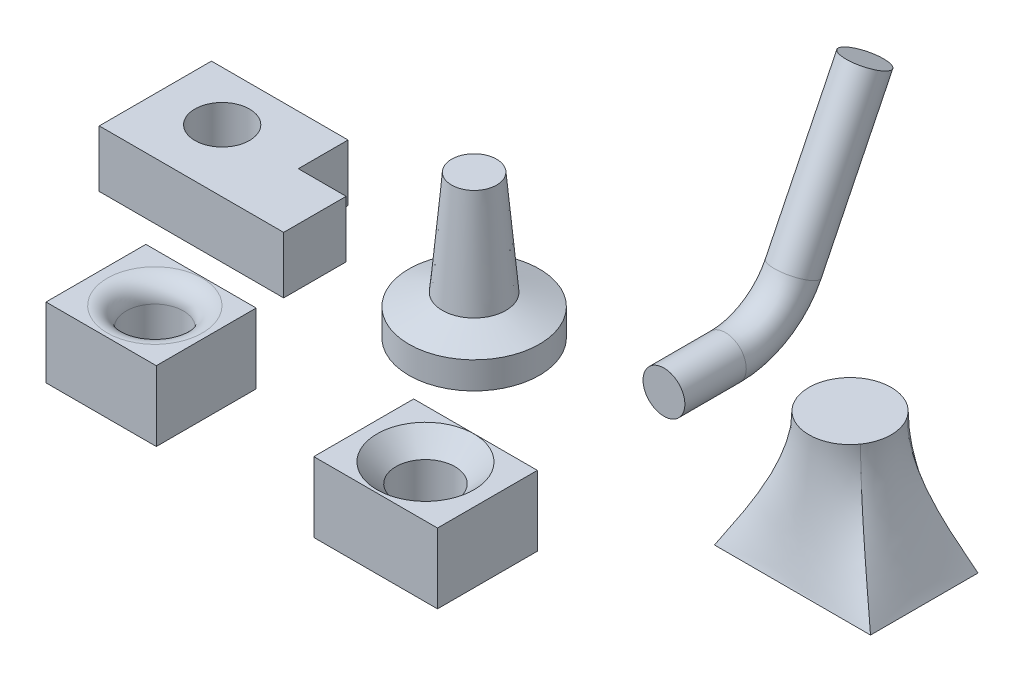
SolidWorks part; units mm, degrees
ref_plane "Front" through (0, 0, 0) normal (0, 0, 1) x (1, 0, 0)
ref_plane "Top" through (0, 0, 0) normal (0, 1, 0) x (1, 0, 0)
ref_plane "Right" through (0, 0, 0) normal (1, 0, 0) x (0, 0, -1)
sketch "Sketch2" plane through (0, 0, 0) normal (0, 1, 0) x (1, 0, 0)
  line L1 (-127.8435, 26.2904) -> (-55.6738, 26.2904)
  line L2 (-127.8435, 26.2904) -> (-127.8435, -32.9919)
  line L3 (-127.8435, -32.9919) -> (-55.6738, -32.9919)
  line L4 (-55.6738, 26.2904) -> (-55.6738, -32.9919)
  line L5 (-55.6738, -32.9919) -> (-30.4144, -32.9919)
  line L6 (-55.6738, -32.9919) -> (-55.6738, 0)
  line L7 (-55.6738, 0) -> (-30.4144, 0)
  line L8 (-30.4144, -32.9919) -> (-30.4144, 0)
  circle A0 centre (-95.8827, 0) radius 14.4339
extrude "Extrude1" add sketch "Sketch2" along normal blind 30
sketch "Sketch3" plane through (0, 0, 0) normal (0, 0, 1) x (1, 0, 0)
  line L0 (2.7361, -0.888) -> (2.7361, 13.365)
  line L1 (2.7361, 13.365) -> (20.4416, 19.9587)
  line L2 (20.4416, 19.9587) -> (25.3289, 74.8807)
  line L3 (37.206, 90.523) -> (37.206, -29.3977) construction
  line L4 (25.3289, 74.8807) -> (37.206, 74.8807)
  line L5 (2.7361, -0.888) -> (37.206, -0.888)
  line L6 (37.206, 74.8807) -> (37.206, -0.888)
revolve "Revolve1" add sketch "Sketch3" angle 360 about L3
sketch "Sketch4" plane through (0, 0, 0) normal (0, 0, 1) x (1, 0, 0)
  circle A0 centre (137.4729, 24.3476) radius 11.0546
ref_plane "Plane4" through (137.4729, 0, 0) normal (1, 0, 0) x (0, 0, -1)
sketch "Sketch5" plane through (137.4729, 0, 0) normal (1, 0, 0) x (0, 0, -1)
  line L0 (0, 24.3476) -> (32.4371, 24.3476)
  line L1 (68.3472, 46.7276) -> (106.1195, 123.7085)
  arc A0 (32.4371, 24.3476) -> (68.3472, 46.7276) centre (32.4371, 64.3476) ccw
  dimension "D1" = 40
sweep "Sweep2" add profiles "Sketch4" path "Sketch5"
sketch "Sketch6" plane through (0, 0, 0) normal (0, 1, 0) x (1, 0, 0)
  line L1 (196.3964, 24.5483) -> (278.8242, 24.5483)
  line L2 (196.3964, 24.5483) -> (196.3964, -32.2297)
  line L3 (196.3964, -32.2297) -> (278.8242, -32.2297)
  line L4 (278.8242, 24.5483) -> (278.8242, -32.2297)
ref_plane "Plane5" through (0, 64.8453, 0) normal (0, 1, 0) x (-1, 0, 0)
sketch "Sketch7" plane through (0, 64.8453, 0) normal (0, 1, 0) x (-1, 0, 0)
  circle A0 centre (-235.781, 0) radius 21.7133
loft "Loft1" add profiles "Sketch6", "Sketch7"
sketch "Sketch8" plane through (0, 0, 0) normal (0, 1, 0) x (1, 0, 0)
  line L1 (-54.3366, -81.8567) -> (3.9294, -81.8567)
  line L2 (-54.3366, -81.8567) -> (-54.3366, -134.6187)
  line L3 (-54.3366, -134.6187) -> (3.9294, -134.6187)
  line L4 (3.9294, -81.8567) -> (3.9294, -134.6187)
  line L5 (87.1216, -81.8567) -> (152.4671, -81.8567)
  line L6 (87.1216, -81.8567) -> (87.1216, -134.6187)
  line L7 (87.1216, -134.6187) -> (152.4671, -134.6187)
  line L8 (152.4671, -81.8567) -> (152.4671, -134.6187)
  circle A0 centre (119.0072, -107.5079) radius 15.6088
  circle A1 centre (-23.958, -107.5079) radius 15.1013
extrude "Extrude2" add sketch "Sketch8" along normal blind 37
fillet "Fillet1" radius 10
chamfer "Chamfer1" distance 10 angle 45
